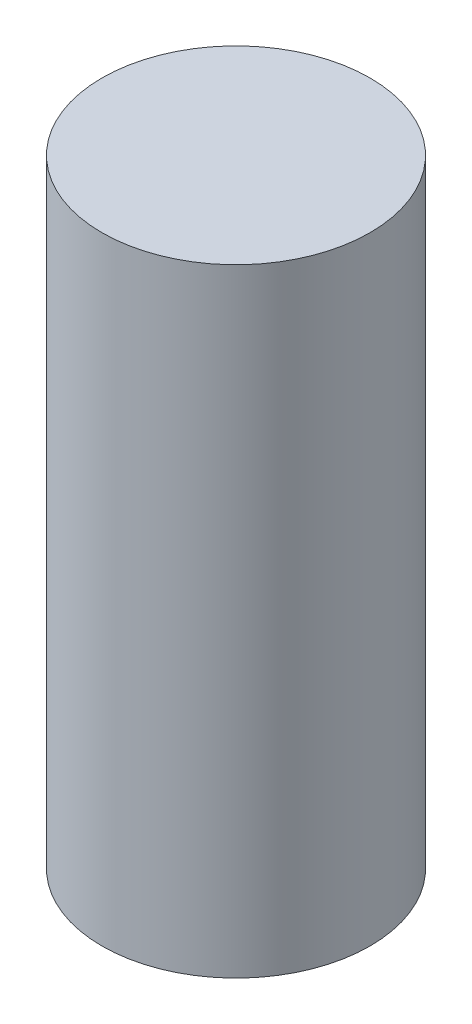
SolidWorks part; units mm, degrees
ref_plane "Front Plane" through (0, 0, 0) normal (0, 0, 1) x (1, 0, 0)
ref_plane "Top Plane" through (0, 0, 0) normal (0, 1, 0) x (1, 0, 0)
ref_plane "Right Plane" through (0, 0, 0) normal (1, 0, 0) x (0, 0, -1)
sketch "Sketch1" plane through (0, 0, 0) normal (0, 1, 0) x (1, 0, 0)
  circle A0 centre (0, 0) radius 9.0043
  dimension "D1" = 18.0086
extrude "Boss-Extrude1" add sketch "Sketch1" along normal blind 41.5036
